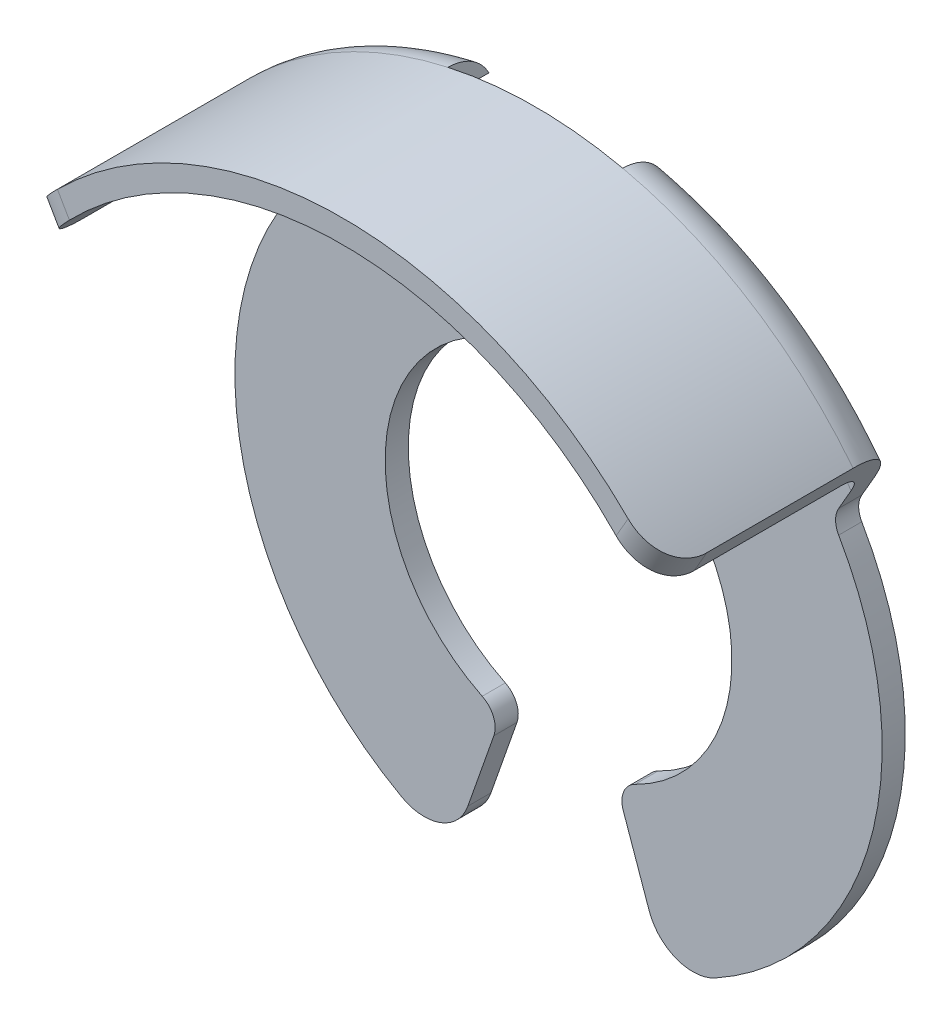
SolidWorks part; units mm, degrees
ref_plane "Front Plane" through (0, 0, 0) normal (0, 0, 1) x (1, 0, 0)
ref_plane "Top Plane" through (0, 0, 0) normal (0, 1, 0) x (1, 0, 0)
ref_plane "Right Plane" through (0, 0, 0) normal (1, 0, 0) x (0, 0, -1)
sketch "Sketch1" plane through (0, 0, 0) normal (0, 0, 1) x (1, 0, 0)
  circle A0 centre (0, 0) radius 4.5
  circle A1 centre (0, 0) radius 10.5
  dimension "D1" = 9
  dimension "D2" = 21
extrude "Boss-Extrude1" add sketch "Sketch1" against normal blind 6.2
sketch "Sketch2" plane through (0, 0, 0) normal (0, 0, 1) x (1, 0, 0)
  circle A0 centre (0, 0) radius 9.9
  dimension "D1" = 19.8
extrude "Cut-Extrude1" cut sketch "Sketch2" against normal blind 5.6
sketch "Sketch3" plane through (0, 0, 0) normal (0, 0, 1) x (1, 0, 0)
  line L0 (-8.247, 6.4989) -> (-7.093, 4.5)
  line L1 (8.247, 6.4989) -> (7.093, 4.5)
  circle A0 centre (0, 0) radius 10.5 construction
  arc A1 (-7.093, 4.5) -> (7.093, 4.5) centre (0, 0) ccw
  circle A2 centre (0, 0) radius 4.5 construction
  arc A4 (-8.247, 6.4989) -> (8.247, 6.4989) centre (0, 0) ccw
  point P7 (-8.4, 0)
  point P9 (8.4, 0)
  point P10 (0, 4.5)
  dimension "D1" = 60
  dimension "D2" = 16.8
extrude "Cut-Extrude2" cut sketch "Sketch3" against normal through all
sketch "Sketch4" plane through (0, 0, -5.6) normal (0, 0, 1) x (1, 0, 0)
  line L0 (0, 0) -> (-1.4918, -4.2455) construction
  line L1 (0, 0) -> (1.4918, -4.2455) construction
  line L2 (-1.4918, 4.2455) -> (-2.8566, 8.1296)
  line L3 (0, 0) -> (-1.4918, 4.2455) construction
  line L4 (0, 0) -> (1.4918, 4.2455) construction
  line L5 (2.8566, 8.1296) -> (1.4918, 4.2455)
  line L6 (1.4918, 4.2455) -> (1.4918, -4.2455) construction
  line L7 (-1.4918, 4.2455) -> (-1.4918, -4.2455) construction
  line L8 (-1.4918, -4.2455) -> (-2.3535, -6.6978)
  line L9 (1.4918, -4.2455) -> (2.3535, -6.6978)
  arc A0 (1.9624, 9.7036) -> (-1.9624, 9.7036) centre (0, 0) ccw
  arc A1 (7.9225, 5.9367) -> (-7.9225, 5.9367) centre (0, 0) ccw construction
  arc A2 (-1.4918, 4.2455) -> (-1.4918, -4.2455) centre (0, 0) ccw
  circle A3 centre (0, 0) radius 4.5 construction
  arc A4 (-2.8566, 8.1296) -> (-1.9624, 9.7036) centre (-1.7245, 8.5274) cw
  arc A6 (1.9624, 9.7036) -> (2.8566, 8.1296) centre (1.7245, 8.5274) cw
  arc A7 (-2.3535, -6.6978) -> (-4.0666, -7.35) centre (-3.4857, -6.3) cw
  arc A8 (-7.093, 4.5) -> (7.093, 4.5) centre (0, 0) ccw construction
  arc A9 (2.3535, -6.6978) -> (4.0666, -7.35) centre (3.4857, -6.3) ccw
  arc A10 (4.0666, -7.35) -> (-4.0666, -7.35) centre (0, 0) cw
  arc A11 (8.247, 6.4989) -> (-8.247, 6.4989) centre (0, 0) ccw construction
  arc A12 (1.4918, -4.2455) -> (1.4918, 4.2455) centre (0, 0) ccw
  point P1 (-3.4857, -7.5)
  point P30 (3.4857, -7.5)
  point P31 (0, 10.5)
  dimension "D2" = 1.2
  dimension "D1" = 18
extrude "Cut-Extrude3" cut sketch "Sketch4" against normal up to vertex
fillet "Fillet1" radius 1.2 3 edges at (0, 10.5, -6.2) (8.0847, 6.2178, 0) (-8.0847, 6.2178, 0)
fillet "Fillet2" radius 0.6 8 edges at (5.2891, 8.3687, -5.6) (-5.2891, 8.3687, -5.6) (-1.4918, -4.2455, -5.9) (1.4918, -4.2455, -5.9) (-1.4918, 4.2455, -5.9) (1.4918, 4.2455, -5.9) (-7.093, 4.5, -5.9) (7.093, 4.5, -5.9)
sketch "Sketch5" plane through (0, -4.5, -6.2) normal (0, 0, 1) x (1, 0, 0)
  line L0 (-2.2678, 10.9539) -> (-2.2678, 15)
  line L5 (2.2678, 10.9539) -> (2.2678, 15)
  line L6 (2.2678, 10.9539) -> (-2.2678, 10.9539)
  line L7 (1.679, 9.2782) -> (2.8566, 12.6296) construction
  line L8 (-2.8566, 12.6296) -> (-1.679, 9.2782) construction
  line L10 (-2.2678, 15) -> (2.2678, 15)
  arc A0 (8.247, 10.9989) -> (-8.247, 10.9989) centre (0, 4.5) ccw construction
extrude "Cut-Extrude5" cut sketch "Sketch5" along normal blind 1.2
